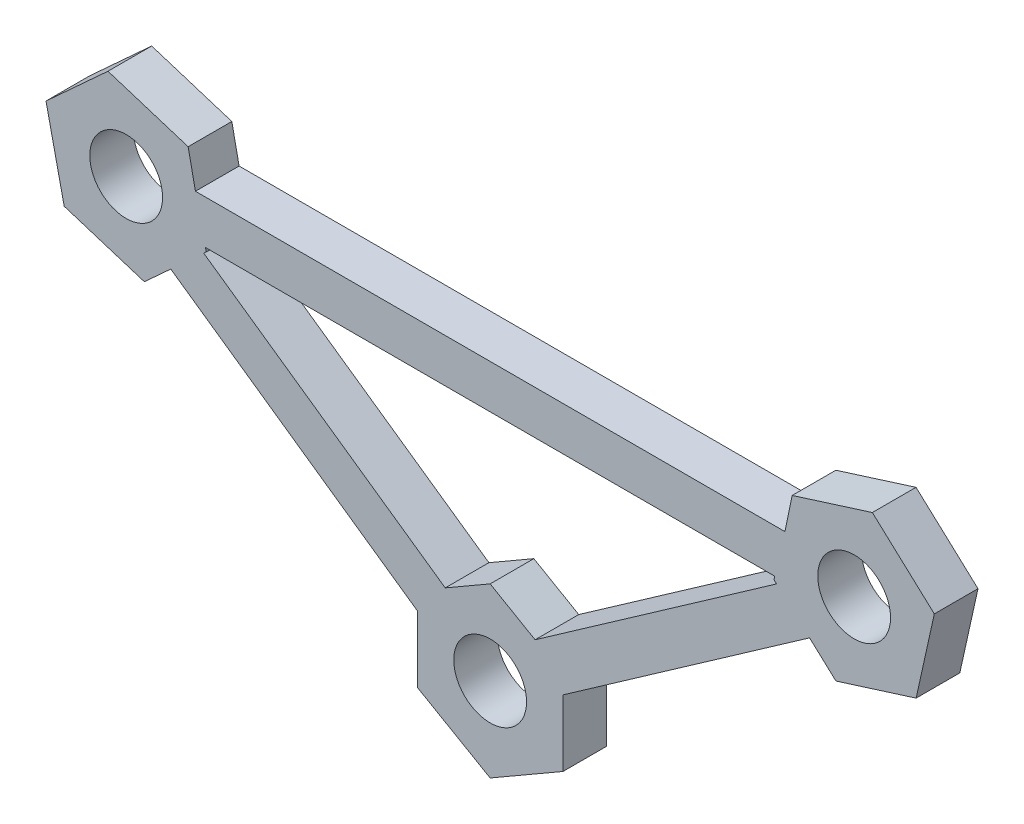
SolidWorks part; units mm, degrees
ref_plane "Alzado" through (0, 0, 0) normal (0, 0, 1) x (1, 0, 0)
ref_plane "Planta" through (0, 0, 0) normal (0, 1, 0) x (1, 0, 0)
ref_plane "Vista lateral" through (0, 0, 0) normal (1, 0, 0) x (0, 0, -1)
sketch "Croquis1" plane through (0, 0, 0) normal (0, 0, 1) x (1, 0, 0)
  line L0 (0, 0) -> (0, 51470.2579) construction
  line L1 (0, 0) -> (51470.2579, 0) construction
  line L8 (0, -8.7526) -> (-25, 8.7526) construction
  line L9 (-25, 8.7526) -> (25, 8.7526) construction
  line L10 (25, 8.7526) -> (0, -8.7526) construction
  line L11 (25, 8.7526) -> (25, -8.7526) construction
  line L12 (25, -8.7526) -> (0, -8.7526) construction
  line L15 (-25, 8.7526) -> (-29.0958, 11.6205) construction
  line L20 (0, -14.8565) -> (-40.858, 13.7526) construction
  line L21 (-40.858, 13.7526) -> (40.858, 13.7526) construction
  line L22 (40.858, 13.7526) -> (0, -14.8565) construction
  line L23 (0, -14.8565) -> (-5.7358, -10.8402) construction
  line L24 (-5.7358, -10.8402) -> (-5.7358, -6.5675) construction
  line L25 (-5.7358, -6.5675) -> (-21.9633, 4.7951) construction
  line L26 (4.015, -4.1101) -> (20.2426, 7.2526) construction
  line L27 (-20.2426, 7.2526) -> (20.2426, 7.2526) construction
  line L28 (5.7358, -6.5675) -> (21.9633, 4.7951) construction
  line L29 (5.7358, -10.8402) -> (5.7358, -6.5675) construction
  line L30 (0, -14.8565) -> (5.7358, -10.8402) construction
  line L31 (0, -2.6487) -> (4.015, -4.1101) construction
  line L32 (0, -2.6487) -> (-4.015, -4.1101) construction
  line L33 (-4.015, -4.1101) -> (-20.2426, 7.2526) construction
  line L34 (-40.858, 13.7526) -> (-25.9784, 3.3338) construction
  line L35 (-25.9784, 3.3338) -> (-21.9633, 4.7951) construction
  line L36 (40.858, 13.7526) -> (25.9784, 3.3338) construction
  line L37 (-22.6933, 13.7526) -> (-20.2426, 10.2526) construction
  line L38 (-22.6933, 13.7526) -> (-40.858, 13.7526) construction
  line L39 (-40.858, 13.7526) -> (0, 0.8701) construction
  line L40 (25.9784, 3.3338) -> (21.9633, 4.7951) construction
  line L41 (22.6933, 13.7526) -> (40.858, 13.7526) construction
  line L42 (22.6933, 13.7526) -> (20.2426, 10.2526) construction
  line L43 (-20.2426, 10.2526) -> (20.2426, 10.2526) construction
  line L44 (-25.9784, 3.3338) -> (-30.8933, 6.7752) construction
  line L45 (-22.6933, 13.7526) -> (-28.6933, 13.7526) construction
  line L46 (-28.6933, 13.7526) -> (-30.8933, 6.7752) construction
  line L47 (25.9784, 3.3338) -> (30.8933, 6.7752) construction
  line L48 (28.6933, 13.7526) -> (30.8933, 6.7752) construction
  line L49 (22.6933, 13.7526) -> (28.6933, 13.7526) construction
  line L50 (-5, -11.6393) -> (-5, -7.0827)
  line L51 (0, -14.5261) -> (5, -11.6393)
  line L52 (5, -11.6393) -> (5, -5.8658) construction
  line L53 (5, -5.8658) -> (0, -2.9791) construction
  line L54 (0, -2.9791) -> (-5, -5.8658) construction
  line L55 (-5, -5.8658) -> (-5, -11.6393) construction
  line L56 (-5, -11.6393) -> (0, -14.5261)
  line L57 (-30.5063, 10.4887) -> (-29.2567, 4.8521)
  line L58 (-29.2567, 4.8521) -> (-23.7504, 3.1159)
  line L59 (-23.7504, 3.1159) -> (-19.4937, 7.0165) construction
  line L60 (-19.4937, 7.0165) -> (-20.7433, 12.6531) construction
  line L61 (-20.7433, 12.6531) -> (-26.2496, 14.3892)
  line L62 (-26.2496, 14.3892) -> (-30.5063, 10.4887)
  line L63 (-5, -7.0827) -> (-21.9376, 4.7771)
  line L64 (-23.7504, 3.1159) -> (-21.9376, 4.7771)
  line L65 (0, -2.9791) -> (-3.0858, -4.7607)
  line L66 (-3.0858, -4.7607) -> (-19.672, 6.8531)
  line L67 (-19.672, 6.8531) -> (-19.4937, 7.0165)
  line L69 (19.4937, 7.0165) -> (20.7433, 12.6531) construction
  line L70 (23.7504, 3.1159) -> (19.4937, 7.0165) construction
  line L71 (0, -2.9791) -> (5, -5.8658) construction
  line L72 (28.6933, 13.7526) -> (30.8933, 6.7752) construction
  line L73 (22.6933, 13.7526) -> (28.6933, 13.7526) construction
  line L74 (25.9784, 3.3338) -> (30.8933, 6.7752) construction
  line L75 (40.858, 13.7526) -> (0, 0.8701) construction
  line L76 (22.6933, 13.7526) -> (40.858, 13.7526) construction
  line L77 (22.6933, 13.7526) -> (20.2426, 10.2526) construction
  line L78 (25.9784, 3.3338) -> (21.9633, 4.7951) construction
  line L79 (40.858, 13.7526) -> (25.9784, 3.3338) construction
  line L80 (4.015, -4.1101) -> (20.2426, 7.2526) construction
  line L81 (0, -2.6487) -> (4.015, -4.1101) construction
  line L82 (5.7358, -6.5675) -> (21.9633, 4.7951) construction
  line L83 (25, 8.7526) -> (29.0958, 11.6205) construction
  line L84 (0, -8.7526) -> (25, 8.7526) construction
  line L85 (19.672, 6.8531) -> (19.4937, 7.0165)
  line L86 (3.0858, -4.7607) -> (19.672, 6.8531)
  line L87 (0, -2.9791) -> (3.0858, -4.7607)
  line L88 (23.7504, 3.1159) -> (21.9376, 4.7771)
  line L89 (5, -7.0827) -> (21.9376, 4.7771)
  line L90 (26.2496, 14.3892) -> (30.5063, 10.4887)
  line L91 (20.7433, 12.6531) -> (26.2496, 14.3892)
  line L92 (29.2567, 4.8521) -> (23.7504, 3.1159)
  line L93 (30.5063, 10.4887) -> (29.2567, 4.8521)
  line L94 (-20.7433, 12.6531) -> (-20.2426, 10.2526)
  line L95 (-20.2426, 10.2526) -> (20.2426, 10.2526)
  line L96 (20.2426, 10.2526) -> (20.7433, 12.6531)
  line L97 (19.4937, 7.0165) -> (19.5461, 7.2526)
  line L98 (19.5461, 7.2526) -> (-19.5497, 7.2526)
  line L99 (-19.5497, 7.2526) -> (-19.4937, 7.0165)
  line L100 (5, -7.0827) -> (5, -11.6393)
  circle A3 centre (-25, 8.7526) radius 2.5
  circle A4 centre (25, 8.7526) radius 2.5
  circle A5 centre (0, -8.7526) radius 2.5
  circle A6 centre (0, -8.7526) radius 5 construction
  circle A7 centre (-25, 8.7526) radius 5 construction
  circle A8 centre (25, 8.7526) radius 5 construction
  circle A9 centre (25, 8.7526) radius 2.5
  point P7 (0, 8.7526)
  point P9 (25, 0)
  dimension "D2" = 5
  dimension "D9" = 10
  dimension "D1" = 5
  dimension "D3" = 5
  dimension "D4" = 35
  dimension "D5" = 50
  dimension "D6" = 3
  dimension "D7" = 1.5
  dimension "D8" = 6
extrude "Saliente-Extruir1" add sketch "Croquis1" along normal mid plane 3 contours L100 L89 L88 L92 L93 L90 L91 L96 L95 L94 L61 L62 L57 L58 L64 L63 L50 L56 L51 A5 A4 A3 L99 L98 L97 L85 L86 L87 L65 L66 L67 | L37 L43 L42 L49 L48 L47 L40 L28 L29 L30 L23 L24 L25 L35 L44 L46 L45
